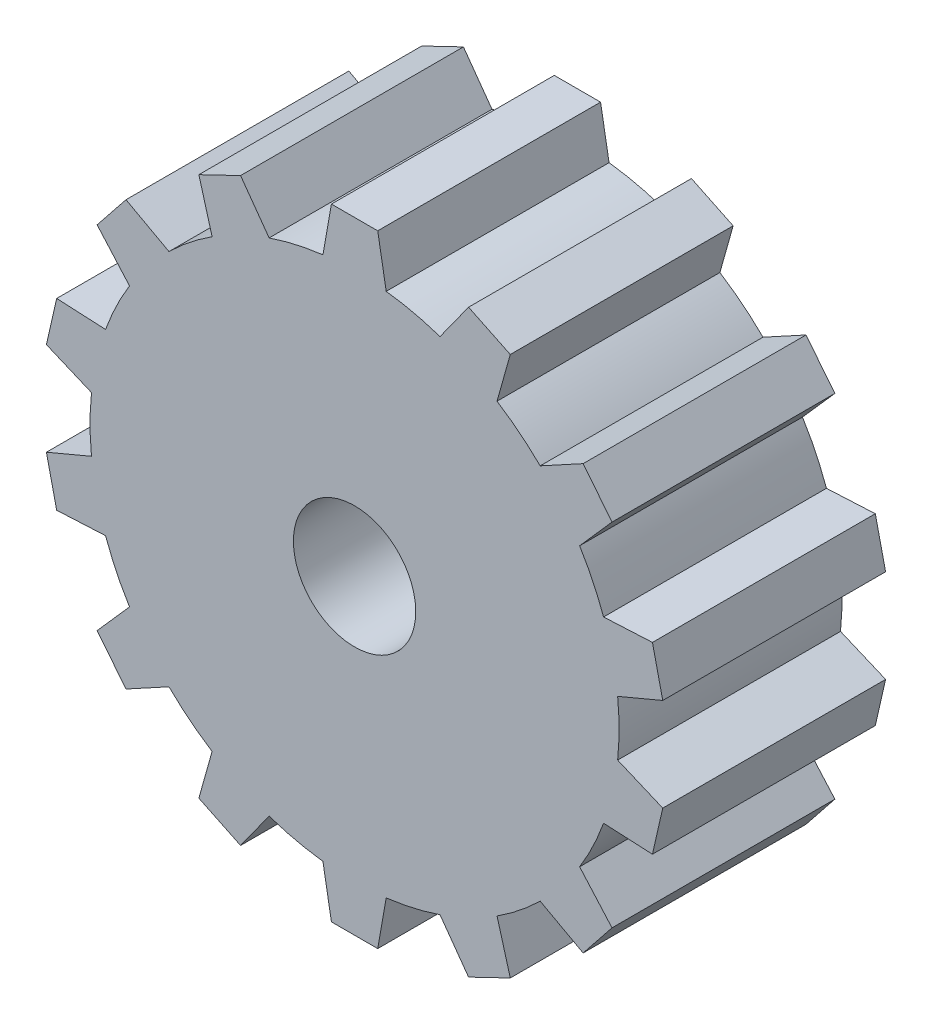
SolidWorks part; units mm, degrees
ref_plane "Front Plane" through (0, 0, 0) normal (0, 0, 1) x (1, 0, 0)
ref_plane "Top Plane" through (0, 0, 0) normal (0, 1, 0) x (1, 0, 0)
ref_plane "Right Plane" through (0, 0, 0) normal (1, 0, 0) x (0, 0, -1)
sketch "Sketch1" plane through (0, 0, 0) normal (0, 0, 1) x (1, 0, 0)
  circle A0 centre (0, 0) radius 4
  dimension "D1" = 8
extrude "Boss-Extrude1" add sketch "Sketch1" along normal blind 3.37
sketch "Sketch2" plane through (0, 0, 3.37) normal (0, 0, 1) x (1, 0, 0)
  circle A0 centre (0, 0) radius 0.925
  dimension "D1" = 1.85
extrude "Cut-Extrude1" cut sketch "Sketch2" against normal up to surface (3.37 mm away)
sketch "Sketch3" plane through (0, 0, 3.37) normal (0, 0, 1) x (1, 0, 0)
  line L0 (-0.35, 4.7) -> (0.35, 4.7)
  line L1 (0.35, 4.7) -> (0.5792, 3.4)
  line L2 (0.5792, 3.4) -> (-0.5792, 3.4)
  line L3 (-0.5792, 3.4) -> (-0.35, 4.7)
  point P4 (0, 4.7)
  point P5 (0, 3.4)
  dimension "D1" = 3.4
  dimension "D2" = 4.7
  dimension "D3" = 80
  dimension "D4" = 0.7
extrude "Boss-Extrude3" add sketch "Sketch3" against normal up to surface (3.37 mm away)
pattern_circular "CirPattern1" count 14 over 360 about axis through (0, 0, 0) along (0, 0, 1) of "Boss-Extrude3"
